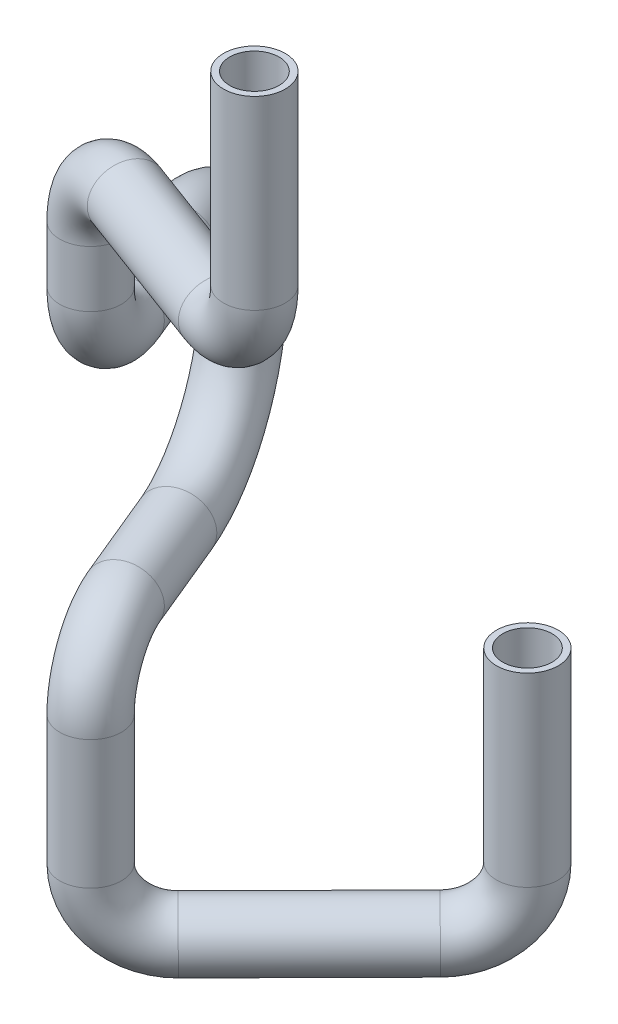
SolidWorks part; units mm, degrees
ref_plane "Plan de face" through (0, 0, 0) normal (0, 0, 1) x (1, 0, 0)
ref_plane "Plan de dessus" through (0, 0, 0) normal (0, 1, 0) x (1, 0, 0)
ref_plane "Plan de droite" through (0, 0, 0) normal (1, 0, 0) x (0, 0, -1)
sketch3d "Esquisse3D1"
  line L0 (0, 0, 0) -> (0, -160.3252, 0) construction
  line L1 (0, 0, 0) -> (0, 0, 57.9177) construction
  line L2 (0, 0, 57.9177) -> (0, -93.0737, 57.9177) construction
  line L3 (0, 0, 0) -> (-59.701, 0, 0) construction
  line L4 (-52.0473, -69.1352, 18.4776) -> (-52.0473, -109.1352, 18.4776) construction
  line L5 (-42.215, 0, 42.215) -> (-42.215, -150, 42.215) construction
  line L6 (0, 0, 0) -> (-42.215, 0, 42.215) construction
  line L7 (0, 0, 57.9177) -> (0, -30, 57.9177)
  line L8 (-42.215, -150, 42.215) -> (0, -149.7751, 0) construction
  line L9 (-9.3726, -40, 54.4313) -> (-32.8424, -40, 45.7013)
  line L10 (-42.215, -50, 42.215) -> (-42.215, -59.1352, 42.215)
  line L11 (-35.1173, -149.9622, 35.1173) -> (-13.9043, -149.8492, 13.9043)
  line L12 (-6.8599, -139.8493, 6.8599) -> (-6.8599, -109.8117, 6.8599)
  line L13 (-46.0418, -69.1352, 32.9762) -> (-52.0473, -69.1352, 18.4776)
  line L15 (-52.0473, -109.1352, 18.4776) -> (-46.0418, -109.1352, 32.9762)
  line L16 (-42.215, -119.1352, 42.215) -> (-42.215, -139.9623, 42.215)
  arc A0 (-13.9043, -149.8492, 13.9043) -> (-6.8599, -139.8493, 6.8599) centre (-13.931, -139.8493, 13.931) ccw
  arc A1 (-35.1173, -149.9622, 35.1173) -> (-42.215, -139.9623, 42.215) centre (-35.1439, -139.9623, 35.1439) ccw
  arc A2 (-32.8424, -40, 45.7013) -> (-42.215, -50, 42.215) centre (-32.8424, -50, 45.7013) ccw
  arc A3 (0, -30, 57.9177) -> (-9.3726, -40, 54.4313) centre (-9.3726, -30, 54.4313) ccw
  arc A4 (-46.0418, -109.1352, 32.9762) -> (-42.215, -119.1352, 42.215) centre (-46.0418, -119.1352, 32.9762) ccw
  arc A5 (-52.0473, -69.1352, 18.4776) -> (-52.0473, -109.1352, 18.4776) centre (-52.0473, -89.1352, 18.4776) ccw
  arc A7 (-46.0418, -69.1352, 32.9762) -> (-42.215, -59.1352, 42.215) centre (-46.0418, -59.1352, 32.9762) ccw
  point P16 (-6.8599, -149.8117, 6.8599)
  point P17 (-6.8599, -139.8493, 21.002)
  point P20 (-42.215, -150, 42.215)
  point P22 (-42.215, -139.9623, 28.0728)
  point P25 (-42.215, -40, 42.215)
  point P26 (-36.3287, -50, 55.0739)
  point P29 (0, -40, 57.9177)
  point P30 (-5.8863, -30, 45.0587)
  point P37 (-42.215, -109.1352, 42.215)
  point P38 (-36.803, -119.1352, 29.1494)
  point P40 (-70.5249, -89.1352, 26.1313)
  point P49 (-42.215, -69.1352, 42.215)
  point P50 (-55.2806, -59.1352, 36.803)
  dimension "D1" = 45
  dimension "D2" = 40
  dimension "D3" = 110
  dimension "D4" = 50
  dimension "D6" = 10
  dimension "D7" = 10
  dimension "D5" = 40
sketch "Esquisse1" plane through (0, 0, 0) normal (0, 1, 0) x (1, 0, 0)
  circle A0 centre (0, -57.9177) radius 5
  circle A1 centre (0, -57.9177) radius 4
  dimension "D1" = 10
  dimension "D2" = 8
sweep "Balayage3" add profiles "Esquisse1" path "Esquisse3D1"
